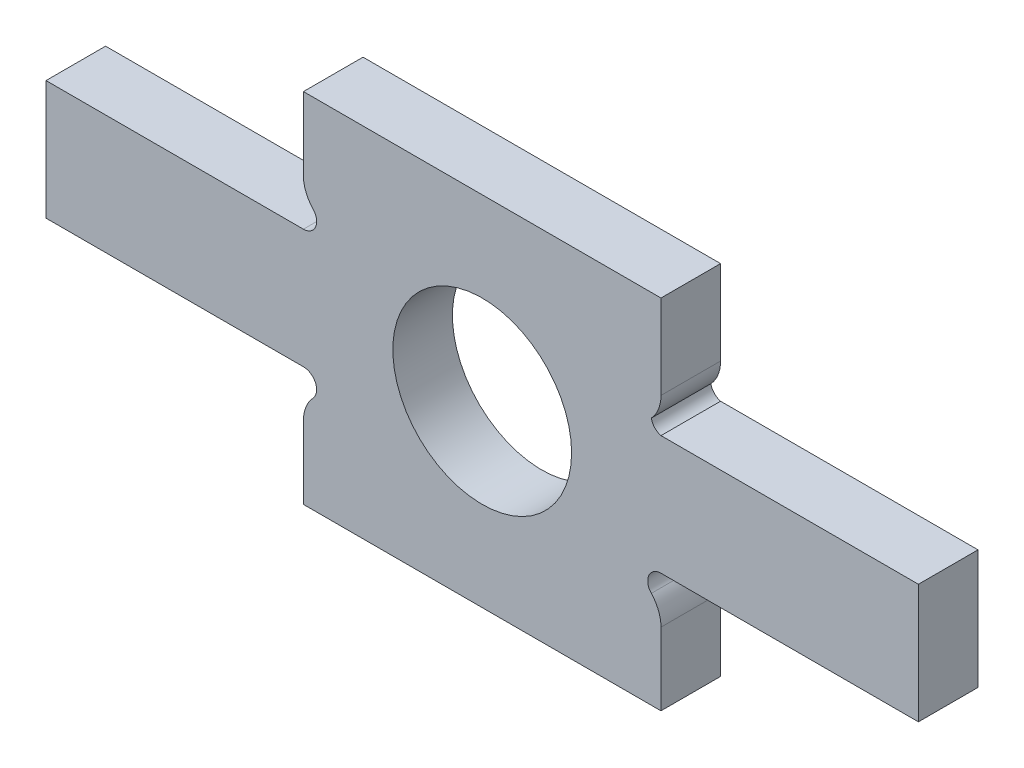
SolidWorks part; units mm, degrees
ref_plane "Plan de face" through (0, 0, 0) normal (0, 0, 1) x (1, 0, 0)
ref_plane "Plan de dessus" through (0, 0, 0) normal (0, 1, 0) x (1, 0, 0)
ref_plane "Plan de droite" through (0, 0, 0) normal (1, 0, 0) x (0, 0, -1)
sketch "Esquisse1" plane through (0, 0, 0) normal (0, 0, 1) x (1, 0, 0)
  line L6 (30, -10) -> (73.2, -10)
  line L7 (73.2, -10) -> (73.2, 10)
  line L8 (73.2, 10) -> (30, 10)
  line L9 (30, 15.8386) -> (30, 30)
  line L10 (30, 30) -> (-30, 30)
  line L11 (-30, 30) -> (-30, 17.374)
  line L12 (-30, 10) -> (-73.2, 10)
  line L13 (-73.2, 10) -> (-73.2, -10)
  line L14 (-73.2, -10) -> (-30, -10)
  line L15 (-30, -17.8386) -> (-30, -30)
  line L16 (-30, -30) -> (30, -30)
  line L17 (30, -30) -> (30, -17.8386)
  arc A0 (30, -17.8386) -> (28.3796, -13.7374) centre (24, -17.8386) ccw
  arc A1 (30, -10) -> (28.3796, -13.7374) centre (30, -12.22) ccw
  arc A2 (28.3796, 11.7374) -> (30, 10) centre (30.5613, 12.1479) ccw
  arc A3 (28.3796, 11.7374) -> (30, 15.8386) centre (24, 15.8386) ccw
  arc A4 (-30, 17.374) -> (-28.3796, 13.7374) centre (-24.0197, 17.8595) ccw
  arc A5 (-30, 10) -> (-28.3796, 13.7374) centre (-30, 12.22) ccw
  arc A6 (-28.3796, -13.7374) -> (-30, -10) centre (-30, -12.22) ccw
  arc A7 (-28.3796, -13.7374) -> (-30, -17.8386) centre (-24, -17.8386) ccw
  dimension "D1" = 60
  dimension "D2" = 20
  dimension "D3" = 20
  dimension "D4" = 30
  dimension "D5" = 60
  dimension "D6" = 30
  dimension "D7" = 10
  dimension "D8" = 10
extrude "Boss.-Extru.1" add sketch "Esquisse1" along normal blind 10
sketch "Esquisse2" plane through (0, 0, 10) normal (0, 0, 1) x (1, 0, 0)
  circle A0 centre (0, 0) radius 15
  dimension "D1" = 30
extrude "Enlèv. mat.-Extru.1" cut sketch "Esquisse2" against normal blind 10
ref_plane "sym" through (0, 0, 5) normal (0, 0, -1) x (-1, 0, 0)
